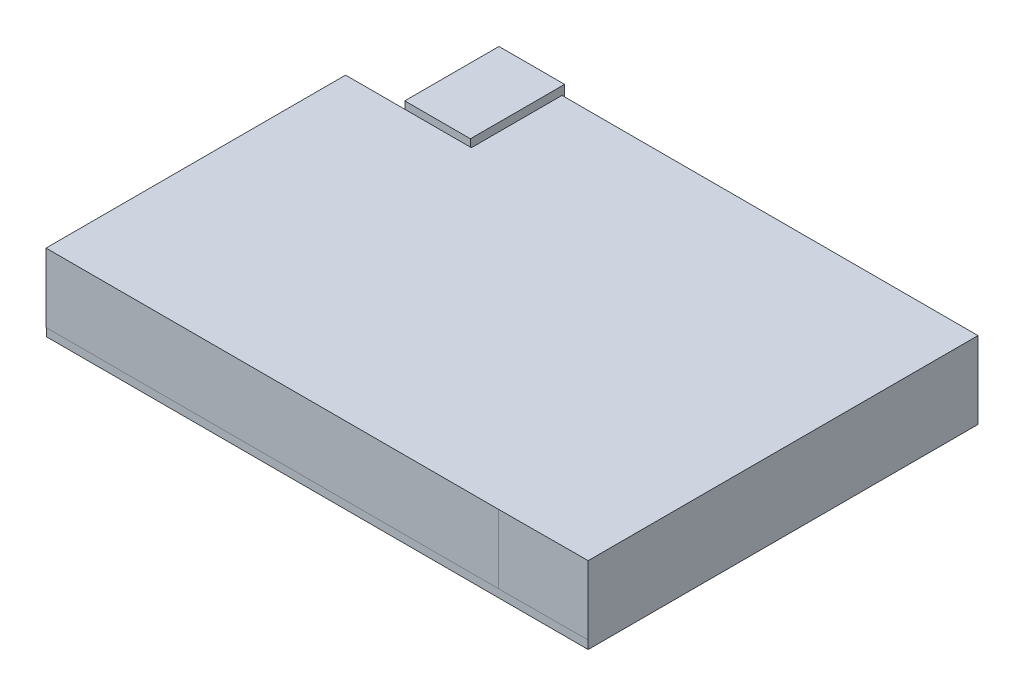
SolidWorks part; units mm, degrees
ref_plane "Front Plane" through (0, 0, 0) normal (0, 0, 1) x (1, 0, 0)
ref_plane "Top Plane" through (0, 0, 0) normal (0, 1, 0) x (1, 0, 0)
ref_plane "Right Plane" through (0, 0, 0) normal (1, 0, 0) x (0, 0, -1)
sketch "Sketch1" plane through (0, 0, 0) normal (0, 1, 0) x (1, 0, 0)
  line L1 (-50.038, 36.0045) -> (50.038, 36.0045)
  line L2 (-50.038, 36.0045) -> (-50.038, -36.0045)
  line L3 (-50.038, -36.0045) -> (50.038, -36.0045)
  line L4 (50.038, 36.0045) -> (50.038, -36.0045)
  line L5 (-50.038, 36.0045) -> (50.038, -36.0045) construction
  line L6 (-50.038, -36.0045) -> (50.038, 36.0045) construction
  point P0 (0, 0)
  dimension "D1" = 100.076
  dimension "D2" = 72.009
extrude "Boss-Extrude1" add sketch "Sketch1" along normal blind 1.524
hole_wizard "#4 Clearance Hole1" positions "Sketch3" profile "Sketch2" hole size "#4" standard "ANSI Inch"
sketch "Sketch3" plane through (0, 1.524, 0) normal (0, 1, 0) x (1, 0, 0)
  line L0 (-50.038, 36.0045) -> (-50.038, -36.0045) construction
  line L1 (50.038, 36.0045) -> (-50.038, 36.0045) construction
  line L3 (50.038, -36.0045) -> (50.038, 36.0045) construction
  line L4 (-50.038, -36.0045) -> (50.038, -36.0045) construction
  point P0 (-47.0916, 32.9565)
  point P6 (47.0662, 32.9565)
  point P17 (-47.0916, -33.0835)
  point P23 (47.0662, -33.0835)
  dimension "D1" = 2.9464
  dimension "D2" = 3.048
  dimension "D3" = 2.9718
  dimension "D7" = 2.921
sketch "Sketch2" plane through (-47.0916, 1.524, -32.9565) normal (1, 0, 0) x (0, 0, 1)
  line L0 (0, 0) -> (0, 1.524)
  line L1 (0, 1.524) -> (1.7272, 1.524)
  line L2 (1.7272, 1.524) -> (1.7272, 0)
  line L5 (1.7272, 0) -> (0, 0)
  line L11 (0, -6.35) -> (0, 107.95) construction
  dimension "Thru Hole Dia." = 3.4544
  dimension "Thru Hole Depth" = 1.524
sketch "Sketch5" plane through (0, 1.524, 0) normal (0, 1, 0) x (1, 0, 0)
  line L1 (-28.3277, 38.0117) -> (-40.4554, 38.0117)
  line L2 (-28.3277, 38.0117) -> (-28.3277, 20.6111)
  line L3 (-28.3277, 20.6111) -> (-40.4554, 20.6111)
  line L4 (-40.4554, 38.0117) -> (-40.4554, 20.6111)
extrude "Boss-Extrude2" add sketch "Sketch5" along normal blind 12.7
sketch "Sketch6" plane through (0, 1.524, 0) normal (0, 1, 0) x (1, 0, 0)
  line L0 (-50.038, 36.0045) -> (-50.038, -36.0045) construction
  line L1 (-50.038, 19.2624) -> (-26.8019, 19.2624)
  line L2 (-50.038, 19.2624) -> (-50.038, -36.0751)
  line L3 (-50.038, -36.0751) -> (33.5116, -36.0751)
  line L5 (-26.8019, 19.2624) -> (-26.8019, 36.0045)
  line L6 (50.038, 36.0045) -> (-28.3277, 36.0045) construction
  line L7 (-26.8019, 36.0045) -> (50.038, 36.0045)
  line L8 (50.038, 36.0045) -> (50.038, -36.0045)
  line L9 (50.038, -36.0045) -> (33.5116, -36.0751)
extrude "Boss-Extrude3" add sketch "Sketch6" along normal blind 12.7
